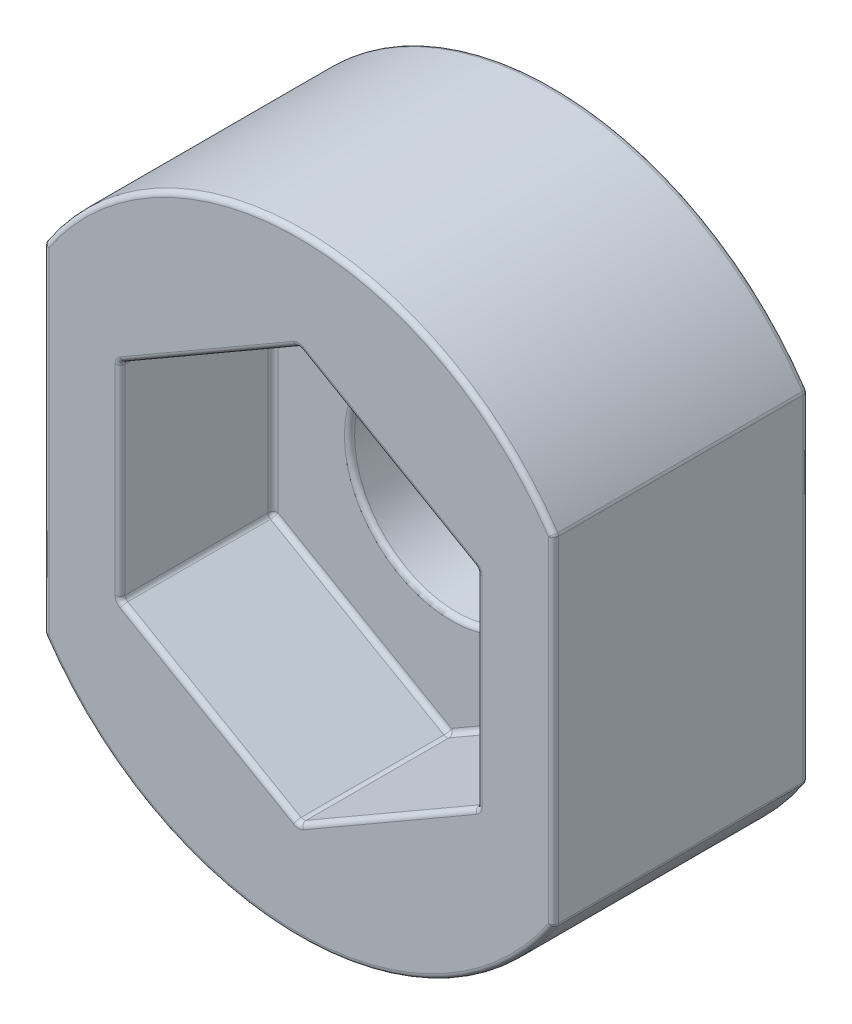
SolidWorks part; units mm, degrees
ref_plane "Face" through (0, 0, 0) normal (0, 0, 1) x (1, 0, 0)
ref_plane "Dessus" through (0, 0, 0) normal (0, 1, 0) x (1, 0, 0)
ref_plane "Droite" through (0, 0, 0) normal (1, 0, 0) x (0, 0, -1)
sketch "Esquisse1" plane through (0, 0, 0) normal (0, 0, 1) x (1, 0, 0)
  circle A0 centre (0, 0) radius 6
  dimension "D1" = 12
extrude "Extrusion1" add sketch "Esquisse1" along normal blind 5
sketch "Esquisse2" plane through (0, 0, 5) normal (0, 0, 1) x (1, 0, 0)
  line L1 (0, 4.0415) -> (-3.5, 2.0207)
  line L2 (-3.5, 2.0207) -> (-3.5, -2.0207)
  line L3 (-3.5, -2.0207) -> (0, -4.0415)
  line L4 (0, -4.0415) -> (3.5, -2.0207)
  line L5 (3.5, -2.0207) -> (3.5, 2.0207)
  line L6 (3.5, 2.0207) -> (0, 4.0415)
  circle A0 centre (0, 0) radius 3.5 construction
  dimension "D1" = 7
extrude "Enlèv. mat.-Extru.1" cut sketch "Esquisse2" against normal blind 3
sketch "Esquisse3" plane through (0, 0, 5) normal (0, 0, 1) x (1, 0, 0)
  line L0 (0, 0) -> (0, 6.5943) construction
  line L1 (-5, 5.6299) -> (-5, -5.0512)
  line L2 (5, 5.6299) -> (8.1585, 5.6299)
  line L3 (5, 5.6299) -> (5, -5.0512)
  line L4 (5, -5.0512) -> (8.1585, -5.0512)
  line L5 (8.1585, 5.6299) -> (8.1585, -5.0512)
  line L6 (-5, 5.6299) -> (-8.1585, 5.6299)
  line L7 (-8.1585, 5.6299) -> (-8.1585, -5.0512)
  line L8 (-5, -5.0512) -> (-8.1585, -5.0512)
  dimension "D1" = 10
extrude "Enlèv. mat.-Extru.2" cut sketch "Esquisse3" against normal through all
sketch "Esquisse4" plane through (0, 0, 2) normal (0, 0, 1) x (1, 0, 0)
  circle A0 centre (0, 0) radius 2
  dimension "D1" = 4
extrude "Enlèv. mat.-Extru.3" cut sketch "Esquisse4" against normal through all
fillet "Congé1" radius 0.1
